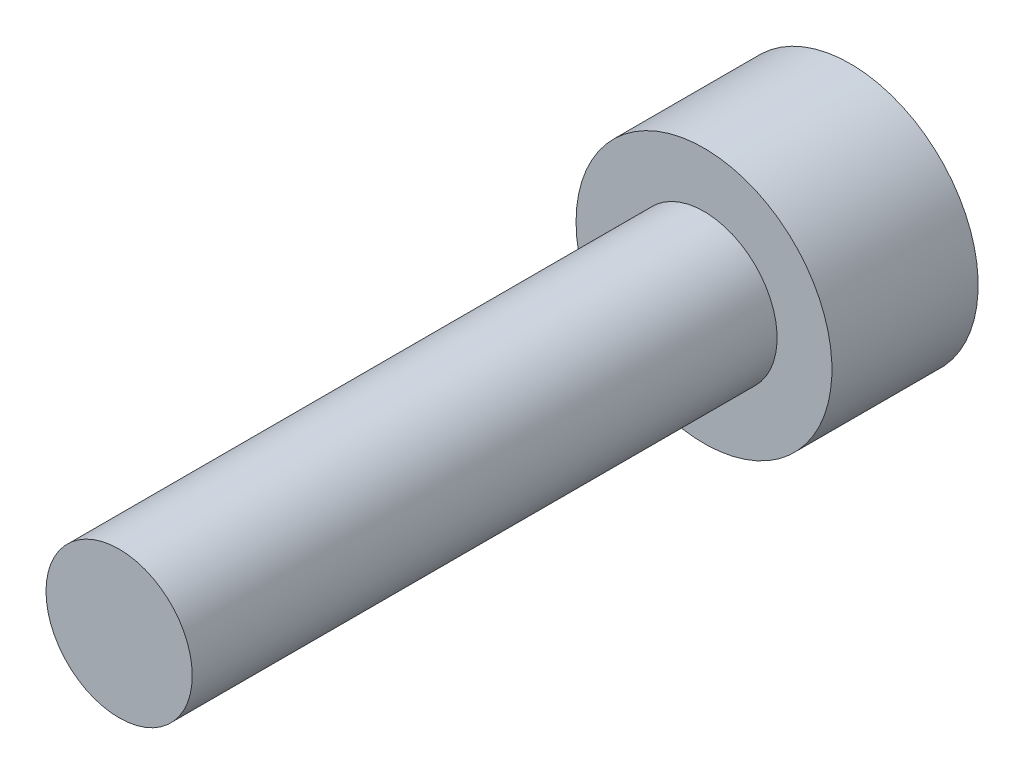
SolidWorks part; units mm, degrees
ref_plane "Front" through (0, 0, 0) normal (0, 0, 1) x (1, 0, 0)
ref_plane "Top" through (0, 0, 0) normal (0, 1, 0) x (1, 0, 0)
ref_plane "Right" through (0, 0, 0) normal (1, 0, 0) x (0, 0, -1)
sketch "Sketch1" plane through (0, 0, 0) normal (0, 0, 1) x (1, 0, 0)
  circle A0 centre (0, 0) radius 2
  dimension "D1" = 4
extrude "Base-Extrude" add sketch "Sketch1" along normal blind 16
sketch "Sketch2" plane through (0, 0, 0) normal (0, 0, -1) x (-1, 0, 0)
  circle A0 centre (0, 0) radius 3.5
  dimension "D1" = 7
extrude "Boss-Extrude1" add sketch "Sketch2" along normal blind 4
sketch "Sketch3" plane through (0, 0, -4) normal (0, 0, -1) x (-1, 0, 0)
  line L1 (-1.0107, -1.847) -> (1.0942, -1.7988)
  line L2 (1.0942, -1.7988) -> (2.1049, 0.0482)
  line L3 (2.1049, 0.0482) -> (1.0107, 1.847)
  line L4 (1.0107, 1.847) -> (-1.0942, 1.7988)
  line L5 (-1.0942, 1.7988) -> (-2.1049, -0.0482)
  line L6 (-2.1049, -0.0482) -> (-1.0107, -1.847)
  circle A0 centre (0, 0) radius 1.8234 construction
extrude "Cut-Extrude1" cut sketch "Sketch3" against normal blind 3
